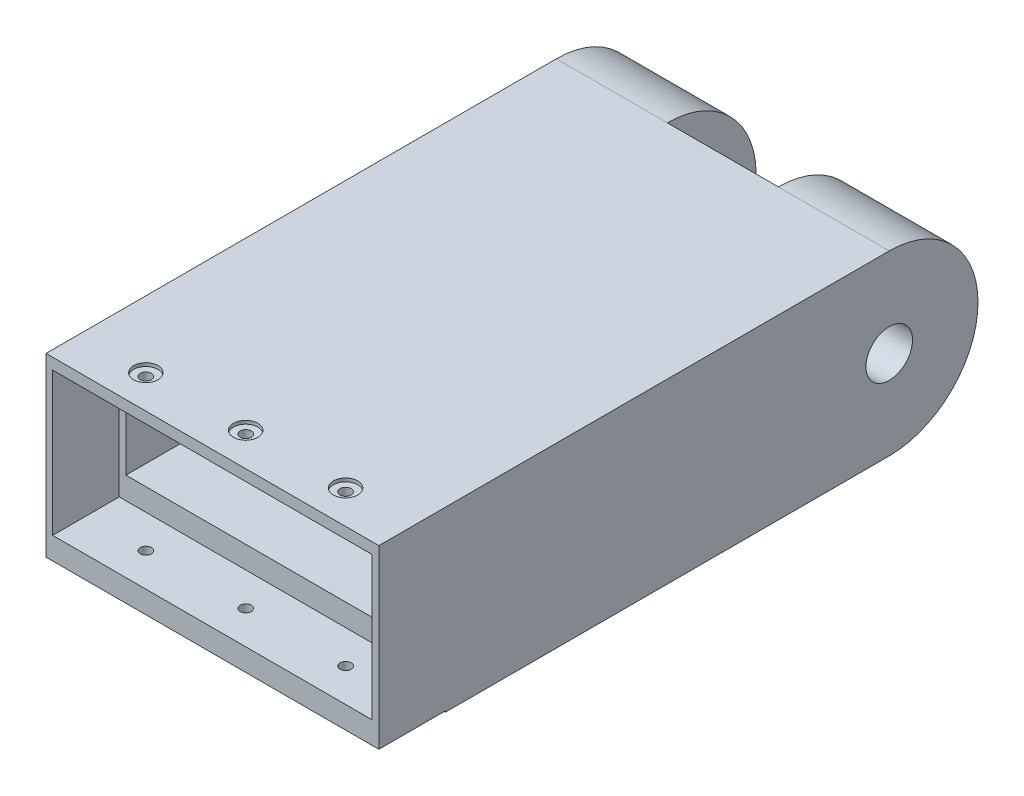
SolidWorks part; units mm, degrees
ref_plane "前视基准面" through (0, 0, 0) normal (0, 0, 1) x (1, 0, 0)
ref_plane "上视基准面" through (0, 0, 0) normal (0, 1, 0) x (1, 0, 0)
ref_plane "右视基准面" through (0, 0, 0) normal (1, 0, 0) x (0, 0, -1)
sketch "草图1" plane through (-32.3024, 0, 0) normal (1, 0, 0) x (0, 0, -1)
  line L0 (-1190, 62.5174) -> (-1390, 62.5174)
  line L1 (-1190, 142.5174) -> (-1390, 142.5174)
  line L2 (-1390, 142.5174) -> (-1390, 63.0247)
  line L4 (-1390, 62.5174) -> (-1390, 63.0247)
  arc A1 (-1190, 142.5174) -> (-1190, 62.5174) centre (-1190, 102.5174) cw
  dimension "D1" = 200
extrude "凸台-拉伸1" add sketch "草图1" along normal blind 50
sketch "草图2" plane through (-32.3024, 0, 0) normal (-1, 0, 0) x (0, 0, 1)
  line L0 (1183.6499, 78.3373) -> (1183.6499, 63.0247)
  line L1 (1183.6499, 63.0247) -> (1390, 63.0247)
  line L2 (1390, 63.0247) -> (1390, 142.5174)
  line L3 (1390, 142.5174) -> (1190, 142.5174)
  line L4 (1190, 142.5174) -> (1190, 127.5174)
  arc A0 (1190, 127.5174) -> (1183.6499, 78.3373) centre (1190, 102.5174) cw
  arc A1 (1190, 77.5174) -> (1190, 127.5174) centre (1190, 102.5174) ccw construction
extrude "凸台-拉伸2" add sketch "草图2" along normal blind 50
sketch "草图3" plane through (-82.3024, 0, 0) normal (-1, 0, 0) x (0, 0, 1)
  line L0 (1183.6499, 78.3373) -> (1183.6499, 63.0247) construction
  line L1 (1190, 142.5174) -> (1390, 142.5174)
  line L2 (1390, 142.5174) -> (1190, 142.5174) construction
  line L3 (1390, 142.5174) -> (1390, 63.0247)
  line L4 (1390, 63.0247) -> (1183.6499, 63.0247)
  arc A0 (1190, 142.5174) -> (1183.6499, 63.0247) centre (1190, 102.5174) ccw
extrude "凸台-拉伸3" add sketch "草图3" along normal blind 50
sketch "草图4" plane through (17.6976, 0, 0) normal (1, 0, 0) x (0, 0, -1)
  line L0 (-1205, 132.5174) -> (-1390, 132.5174)
  line L4 (-1190, 142.5174) -> (-1390, 142.5174) construction
  line L6 (-1205, 122.5174) -> (-1205, 132.5174)
  line L7 (-1205.6535, 83.0247) -> (-1390, 83.0247)
  line L8 (-1390, 83.0247) -> (-1390, 132.5174)
  line L9 (-1390, 63.0247) -> (-1183.6499, 63.0247) construction
  line L11 (-1390, 142.5174) -> (-1390, 62.5174) construction
  arc A0 (-1205, 122.5174) -> (-1205.6535, 83.0247) centre (-1190, 102.5174) ccw
  dimension "D4" = 25
  dimension "D1" = 10
  dimension "D2" = 10
  dimension "D3" = 0
  dimension "D5" = 20
extrude "切除-拉伸1" cut sketch "草图4" against normal offset from surface (138 mm away) 6 from offset 6
sketch "草图5" plane through (0, 63.0247, 0) normal (0, -1, 0) x (1, 0, 0)
  line L1 (-82.3024, 1183.6499) -> (-32.3024, 1183.6499)
  line L2 (-82.3024, 1183.6499) -> (-82.3024, 1223.6499)
  line L3 (-82.3024, 1223.6499) -> (-32.3024, 1223.6499)
  line L4 (-32.3024, 1183.6499) -> (-32.3024, 1223.6499)
  dimension "D1" = 40
  dimension "D2" = 50
extrude "切除-拉伸2" cut sketch "草图5" against normal up to next
sketch "草图6" plane through (0, 0, 1390) normal (0, 0, 1) x (1, 0, 0)
  line L1 (-132.3024, 142.5174) -> (17.6976, 142.5174)
  line L2 (-132.3024, 142.5174) -> (-132.3024, 63.0247)
  line L3 (-132.3024, 63.0247) -> (17.6976, 63.0247)
  line L4 (17.6976, 142.5174) -> (17.6976, 63.0247)
  line L5 (-129.3024, 137.5174) -> (14.6976, 137.5174)
  line L6 (-129.3024, 137.5174) -> (-129.3024, 73.0247)
  line L7 (-129.3024, 73.0247) -> (14.6976, 73.0247)
  line L8 (14.6976, 137.5174) -> (14.6976, 73.0247)
  dimension "D1" = 10
  dimension "D2" = 3
  dimension "D3" = 5
  dimension "D4" = 3
extrude "凸台-拉伸4" add sketch "草图6" along normal blind 30
sketch "草图7" plane through (0, 63.0247, 0) normal (0, -1, 0) x (1, 0, 0)
  line L0 (17.6976, 1420) -> (17.6976, 1183.6499) construction
  line L1 (-132.3024, 1183.6499) -> (-132.3024, 1420) construction
  line L2 (-132.3024, 1420) -> (17.6976, 1420) construction
  circle A0 centre (-102.3024, 1405) radius 5.5
  circle A1 centre (-57.3024, 1405) radius 5.5
  circle A2 centre (-12.3024, 1405) radius 5.5
  dimension "D1" = 11
  dimension "D2" = 11
  dimension "D3" = 11
  dimension "D4" = 75
  dimension "D5" = 30
  dimension "D6" = 30
  dimension "D7" = 15
  dimension "D8" = 15
  dimension "D9" = 15
extrude "切除-拉伸3" cut sketch "草图7" against normal blind 2.5
sketch "草图8" plane through (0, 65.5247, 0) normal (0, -1, 0) x (1, 0, 0)
  line L2 (17.6976, 1420) -> (17.6976, 1183.6499) construction
  circle A0 centre (-102.3024, 1405) radius 2.5
  circle A1 centre (-57.3024, 1405) radius 2.5
  circle A2 centre (-12.3024, 1405) radius 2.5
  circle A3 centre (-57.3024, 1405) radius 5.5 construction
  dimension "D1" = 5
  dimension "D2" = 5
  dimension "D3" = 5
  dimension "D5" = 75
  dimension "D4" = 75
extrude "切除-拉伸4" cut sketch "草图8" against normal up to next
sketch "草图9" plane through (-132.3024, 0, 0) normal (-1, 0, 0) x (0, 0, 1)
  circle A0 centre (1190, 102.5174) radius 10.5
  dimension "D1" = 21
extrude "切除-拉伸5" cut sketch "草图9" against normal through all and the other way through all
sketch "草图10" plane through (0, 137.5174, 0) normal (0, -1, 0) x (1, 0, 0)
  circle A0 centre (-102.3024, 1405) radius 2.5
  circle A1 centre (-57.3024, 1405) radius 2.5
  circle A2 centre (-12.3024, 1405) radius 2.5
extrude "切除-拉伸6" cut sketch "草图10" against normal blind 10
sketch "草图12" plane through (0, 142.5174, 0) normal (0, 1, 0) x (1, 0, 0)
  circle A0 centre (-12.3024, -1405) radius 5.5
  circle A1 centre (-57.3024, -1405) radius 5.5
  circle A2 centre (-102.3024, -1405) radius 5.5
extrude "切除-拉伸7" cut sketch "草图12" against normal blind 1.5
